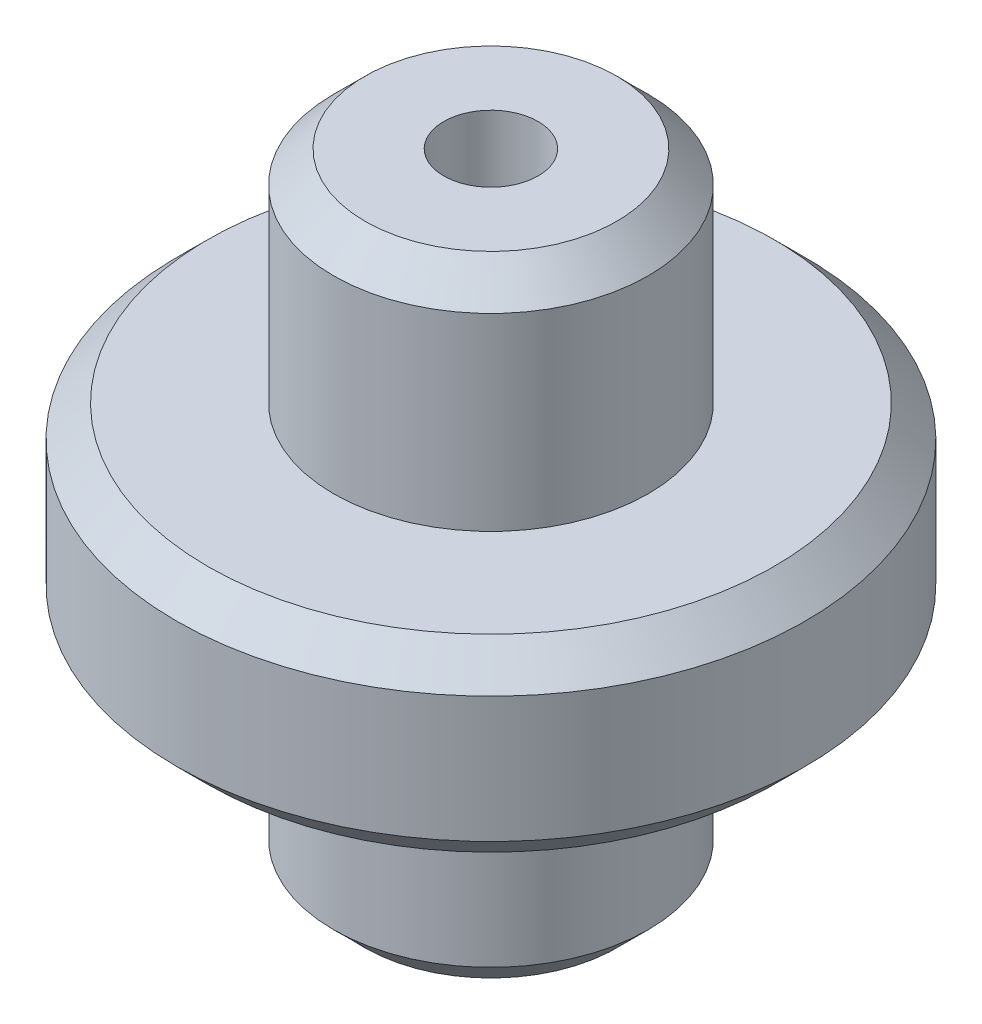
SolidWorks part; units mm, degrees
ref_plane "Front" through (0, 0, 0) normal (0, 0, 1) x (1, 0, 0)
ref_plane "Top" through (0, 0, 0) normal (0, 1, 0) x (1, 0, 0)
ref_plane "Right" through (0, 0, 0) normal (1, 0, 0) x (0, 0, -1)
sketch "Sketch1" plane through (0, 0, 0) normal (0, 1, 0) x (1, 0, 0)
  circle A0 centre (0, 0) radius 10
extrude "Extrude1" add sketch "Sketch1" along normal blind 6
sketch "Sketch2" plane through (0, 6, 0) normal (0, 1, 0) x (-1, 0, 0)
  circle A0 centre (0, 0) radius 5
extrude "Extrude2" add sketch "Sketch2" along normal blind 7
sketch "Sketch3" plane through (0, 0, 0) normal (0, -1, 0) x (1, 0, 0)
  circle A0 centre (0, 0) radius 5
extrude "Extrude3" add sketch "Sketch3" along normal blind 7
sketch "Sketch4" plane through (0, -7, 0) normal (0, -1, 0) x (1, 0, 0)
  circle A0 centre (0, 0) radius 1.5
extrude "Cut-Extrude1" cut sketch "Sketch4" against normal through all
chamfer "Chamfer1" distance 1 angle 45 4 edges at (0, 13, 5) (0, 6, 10) (0, 0, 10) (0, -7, -5)
